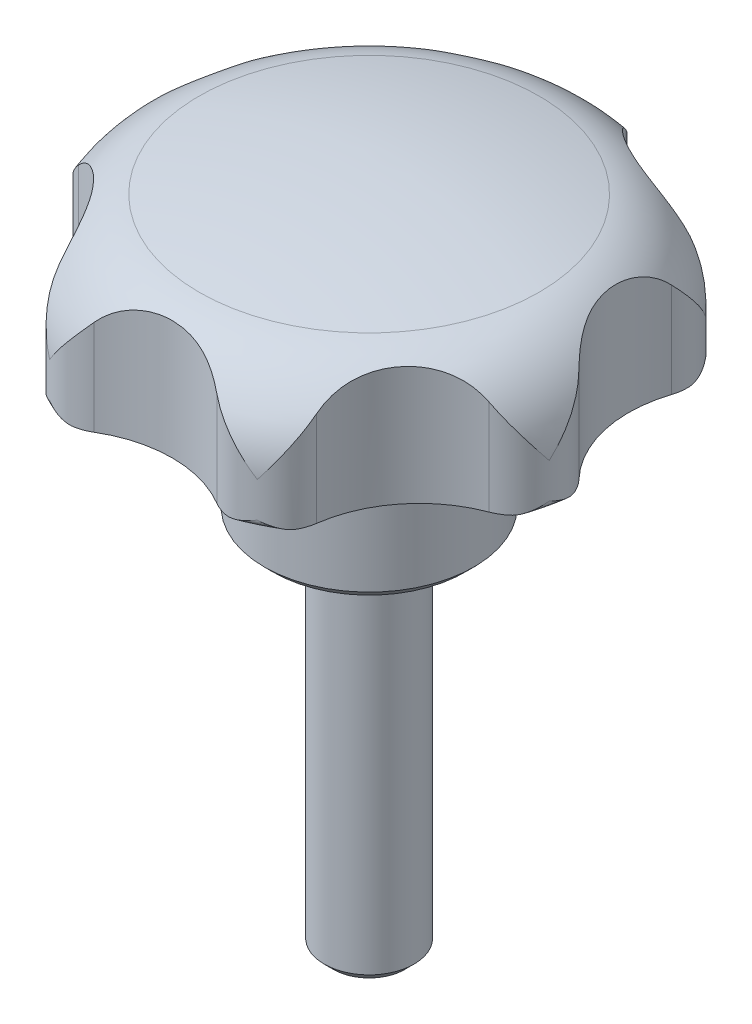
SolidWorks part; units mm, degrees
ref_plane "Face" through (0, 0, 0) normal (0, 0, 1) x (1, 0, 0)
ref_plane "Dessus" through (0, 0, 0) normal (0, 1, 0) x (1, 0, 0)
ref_plane "Droite" through (0, 0, 0) normal (1, 0, 0) x (0, 0, -1)
ref_plane "Plan1" through (0, 0, 0) normal (0, 0, 1) x (1, 0, 0)
sketch "Esquisse1" plane through (0, 0, 0) normal (0, 0, 1) x (1, 0, 0)
  line L0 (16, 12.8486) -> (16, 10.5)
  line L1 (15.5, 10) -> (11.7, 10)
  line L2 (11.2, 10.5) -> (11.2, 16.2792)
  line L3 (8, 16.7333) -> (8, 11)
  line L4 (8, 11) -> (7, 10)
  line L5 (7, 10) -> (7, 0.6)
  line L6 (7, 0.6) -> (6.4, 0)
  line L7 (6.4, 0) -> (0, 0)
  line L8 (0, 0) -> (0, 20)
  line L9 (0, 0) -> (0, 20) construction
  arc A0 (0, 20) -> (11.3636, 18.6916) centre (0, -30) cw
  arc A1 (11.3636, 18.6916) -> (16, 12.8486) centre (10, 12.8486) cw
  arc A2 (16, 10.5) -> (15.5, 10) centre (15.5, 10.5) cw
  arc A3 (11.7, 10) -> (11.2, 10.5) centre (11.7, 10.5) cw
  arc A4 (11.2, 16.2792) -> (10.8126, 16.7663) centre (10.7, 16.2792) ccw
  arc A5 (10.8126, 16.7663) -> (8.5895, 17.2252) centre (0, -30) ccw
  arc A6 (8.5895, 17.2252) -> (8, 16.7333) centre (8.5, 16.7333) ccw
revolve "Révolution1" add sketch "Esquisse1" angle 360 about L9
ref_plane "Plan2" through (0, 0, 0) normal (0, 1, 0) x (-1, 0, 0)
sketch "Esquisse2" plane through (0, 0, 0) normal (0, 1, 0) x (-1, 0, 0)
  circle A0 centre (0, 0) radius 21
  arc A1 (14.8428, 0.8199) -> (15.5988, 3.5603) centre (12.6741, 2.8928) ccw
  arc A2 (15.5988, 3.5603) -> (13.7286, 5.7013) centre (12.6741, 2.8928) ccw
  arc A3 (13.7286, 5.7013) -> (8.6133, 12.1157) centre (16.5407, 13.1908) cw
  arc A4 (8.6133, 12.1157) -> (6.9421, 14.4155) centre (5.6405, 11.7126) ccw
  arc A5 (6.9421, 14.4155) -> (4.1022, 14.2882) centre (5.6405, 11.7126) ccw
  arc A6 (4.1022, 14.2882) -> (-4.1022, 14.2882) centre (0, 21.1564) cw
  arc A7 (-4.1022, 14.2882) -> (-6.9421, 14.4155) centre (-5.6405, 11.7126) ccw
  arc A8 (-6.9421, 14.4155) -> (-8.6133, 12.1157) centre (-5.6405, 11.7126) ccw
  arc A9 (-8.6133, 12.1157) -> (-13.7286, 5.7013) centre (-16.5407, 13.1908) cw
  arc A10 (-13.7286, 5.7013) -> (-15.5988, 3.5603) centre (-12.6741, 2.8928) ccw
  arc A11 (-15.5988, 3.5603) -> (-14.8428, 0.8199) centre (-12.6741, 2.8928) ccw
  arc A12 (-14.8428, 0.8199) -> (-13.0171, -7.1787) centre (-20.6259, -4.7077) cw
  arc A13 (-13.0171, -7.1787) -> (-12.5093, -9.9758) centre (-10.1638, -8.1054) ccw
  arc A14 (-12.5093, -9.9758) -> (-9.8953, -11.0933) centre (-10.1638, -8.1054) ccw
  arc A15 (-9.8953, -11.0933) -> (-2.5035, -14.6531) centre (-9.1794, -19.0612) cw
  arc A16 (-2.5035, -14.6531) -> (0, -16) centre (0, -13) ccw
  arc A17 (0, -16) -> (2.5035, -14.6531) centre (0, -13) ccw
  arc A18 (2.5035, -14.6531) -> (9.8953, -11.0933) centre (9.1794, -19.0612) cw
  arc A19 (9.8953, -11.0933) -> (12.5093, -9.9758) centre (10.1638, -8.1054) ccw
  arc A20 (12.5093, -9.9758) -> (13.0171, -7.1787) centre (10.1638, -8.1054) ccw
  arc A21 (13.0171, -7.1787) -> (14.8428, 0.8199) centre (20.6259, -4.7077) cw
extrude "Enlèv. mat.-Extru.1" cut sketch "Esquisse2" along normal blind 21
ref_plane "Plan3" through (0, 0, 0) normal (0, 1, 0) x (-1, 0, 0)
sketch "Esquisse3" plane through (0, 0, 0) normal (0, 1, 0) x (-1, 0, 0)
  arc A0 (13.0697, 0.5773) -> (13.649, 3.1153) centre (10.7242, 2.4477) ccw
  arc A1 (13.649, 3.1153) -> (12.0259, 5.1506) centre (10.7242, 2.4477) ccw
  arc A2 (12.0259, 5.1506) -> (7.6975, 10.5782) centre (15.4969, 12.3584) cw
  arc A3 (7.6975, 10.5782) -> (6.0744, 12.6136) centre (4.7727, 9.9107) ccw
  arc A4 (6.0744, 12.6136) -> (3.4711, 12.6136) centre (4.7727, 9.9107) ccw
  arc A5 (3.4711, 12.6136) -> (-3.4711, 12.6136) centre (0, 19.8213) cw
  arc A6 (-3.4711, 12.6136) -> (-6.0744, 12.6136) centre (-4.7727, 9.9107) ccw
  arc A7 (-6.0744, 12.6136) -> (-7.6975, 10.5782) centre (-4.7727, 9.9107) ccw
  arc A8 (-7.6975, 10.5782) -> (-12.0259, 5.1506) centre (-15.4969, 12.3584) cw
  arc A9 (-12.0259, 5.1506) -> (-13.649, 3.1153) centre (-10.7242, 2.4477) ccw
  arc A10 (-13.649, 3.1153) -> (-13.0697, 0.5773) centre (-10.7242, 2.4477) ccw
  arc A11 (-13.0697, 0.5773) -> (-11.5249, -6.1908) centre (-19.3244, -4.4107) cw
  arc A12 (-11.5249, -6.1908) -> (-10.9456, -8.7289) centre (-8.6001, -6.8584) ccw
  arc A13 (-10.9456, -8.7289) -> (-8.6001, -9.8584) centre (-8.6001, -6.8584) ccw
  arc A14 (-8.6001, -9.8584) -> (-2.3455, -12.8705) centre (-8.6001, -17.8584) cw
  arc A15 (-2.3455, -12.8705) -> (0, -14) centre (0, -11) ccw
  arc A16 (0, -14) -> (2.3455, -12.8705) centre (0, -11) ccw
  arc A17 (2.3455, -12.8705) -> (8.6001, -9.8584) centre (8.6001, -17.8584) cw
  arc A18 (8.6001, -9.8584) -> (10.9456, -8.7289) centre (8.6001, -6.8584) ccw
  arc A19 (10.9456, -8.7289) -> (11.5249, -6.1908) centre (8.6001, -6.8584) ccw
  arc A20 (11.5249, -6.1908) -> (13.0697, 0.5773) centre (19.3244, -4.4107) cw
  circle A21 centre (0, 0) radius 8
extrude "Enlèv. mat.-Extru.2" cut sketch "Esquisse3" along normal blind 17
ref_plane "Plan4" through (0, 0, 0) normal (0, 0, 1) x (1, 0, 0)
sketch "Esquisse4" plane through (0, 0, 0) normal (0, 0, 1) x (1, 0, 0)
  line L0 (0, 0) -> (3, 0)
  line L1 (3, 0) -> (3, -24.3865)
  line L2 (3, -24.3865) -> (2.3865, -25)
  line L3 (2.3865, -25) -> (0, -25)
  line L4 (0, -25) -> (0, 0)
  line L5 (0, -25) -> (0, 0) construction
revolve "Révolution2" add sketch "Esquisse4" angle 360 about L5
